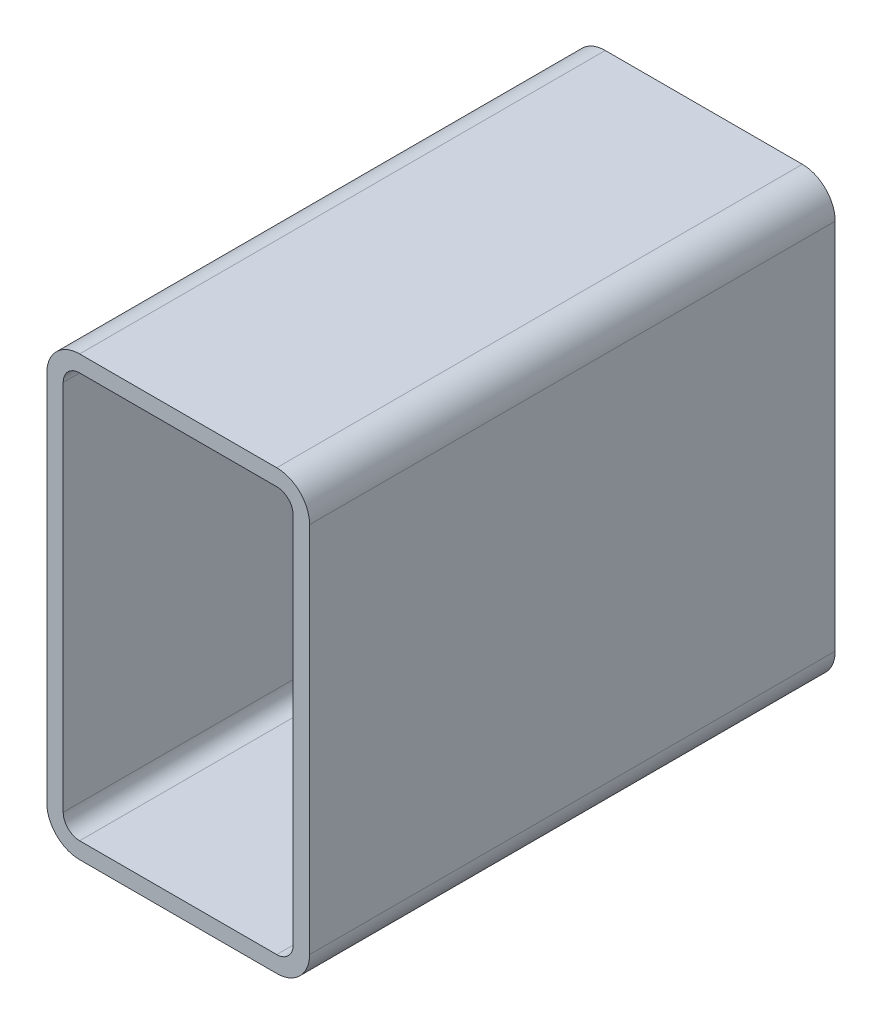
SolidWorks part; units mm, degrees
ref_plane "Front Plane" through (0, 0, 0) normal (0, 0, 1) x (1, 0, 0)
ref_plane "Top Plane" through (0, 0, 0) normal (0, 1, 0) x (1, 0, 0)
ref_plane "Right Plane" through (0, 0, 0) normal (1, 0, 0) x (0, 0, -1)
sketch "Sketch1" plane through (0, 0, 0) normal (0, 0, 1) x (1, 0, 0)
sketch_block_instance "HSS10x6x0.375-1"
sketch_block "HSS10x6x0.375"
extrude "Boss-Extrude1" add sketch "Sketch1" along normal blind 304.8
